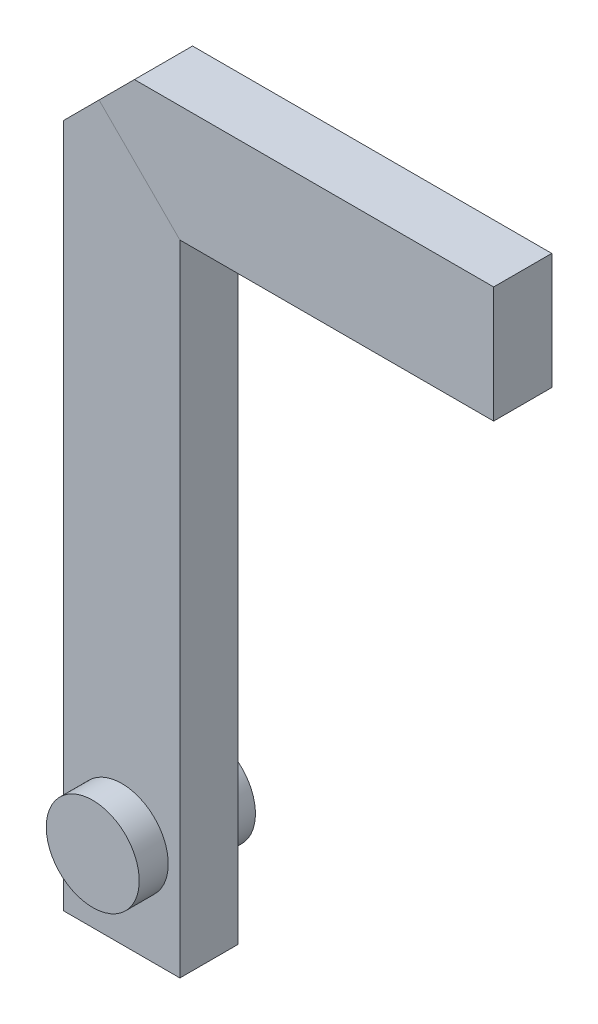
SolidWorks part; units mm, degrees
ref_plane "Front Plane" through (0, 0, 0) normal (0, 0, 1) x (1, 0, 0)
ref_plane "Top Plane" through (0, 0, 0) normal (0, 1, 0) x (1, 0, 0)
ref_plane "Right Plane" through (0, 0, 0) normal (1, 0, 0) x (0, 0, -1)
sketch "Sketch1" plane through (0, 0, 0) normal (0, 0, 1) x (1, 0, 0)
  line L0 (0, 0) -> (0, 38.1)
  line L1 (0, -55) -> (0, 55) construction
  line L2 (0, 38.1) -> (20.32, 38.1)
  dimension "D1" = 38.1
  dimension "D2" = 20.32
sketch3d "3DSketch2"
  line L1 (20.32, 34.925, -1.5875) -> (20.32, 41.275, -1.5875)
  line L2 (20.32, 34.925, -1.5875) -> (20.32, 34.925, 1.5875)
  line L3 (20.32, 34.925, 1.5875) -> (20.32, 41.275, 1.5875)
  line L4 (20.32, 41.275, -1.5875) -> (20.32, 41.275, 1.5875)
  line L5 (20.32, 34.925, -1.5875) -> (20.32, 41.275, 1.5875) construction
  line L6 (20.32, 34.925, 1.5875) -> (20.32, 41.275, -1.5875) construction
  point P0 (20.32, 38.1, 0)
  dimension "D1" = 6.35
  dimension "D2" = 3.175
sweep "Sweep1" add profiles "3DSketch2" path "Sketch1"
sketch "Sketch2" plane through (0, 0, 1.5875) normal (0, 0, 1) x (1, 0, 0)
  line L0 (3.175, 34.925) -> (-3.175, 41.275)
  line L1 (-3.175, 37.4091) -> (0.6909, 41.275)
  line L3 (-3.175, 0) -> (-3.175, 41.275) construction
  line L5 (-3.175, 41.275) -> (20.32, 41.275) construction
  line L6 (-3.175, 37.4091) -> (-3.175, 41.275)
  line L7 (0.6909, 41.275) -> (-3.175, 41.275)
extrude "Cut-Extrude1" cut sketch "Sketch2" against normal through all contours L1 L0 M4 | L1 L7 L0
sketch "Sketch3" plane through (0, 0, 1.5875) normal (0, 0, 1) x (1, 0, 0)
  line L0 (0, 0) -> (0, 5.08)
  line L1 (0, -1.7463) -> (0, 1.7463) construction
  circle A0 centre (0, 5.08) radius 2.54
  dimension "D1" = 5.08
extrude "Boss-Extrude1" add sketch "Sketch3" against normal blind 1.5875 and the other way blind 4.7625 from offset 3.175
